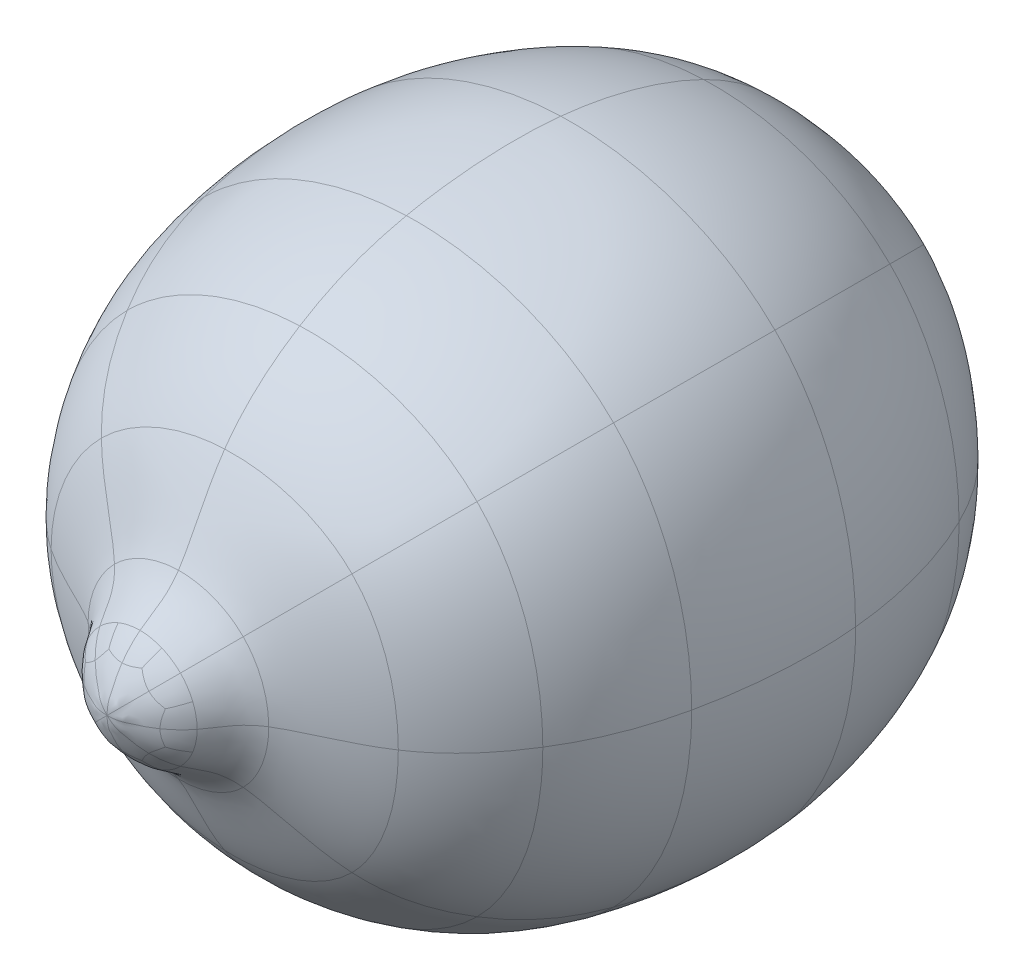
SolidWorks part; units mm, degrees
ref_plane "Front Plane" through (0, 0, 0) normal (0, 0, 1) x (1, 0, 0)
ref_plane "Top Plane" through (0, 0, 0) normal (0, 1, 0) x (1, 0, 0)
ref_plane "Right Plane" through (0, 0, 0) normal (1, 0, 0) x (0, 0, -1)
imported_body "Lime Test.step<1>"
scale "Scale1" bodies to scale 101 scale about origin uniform scaling yes scale factor 1.2
